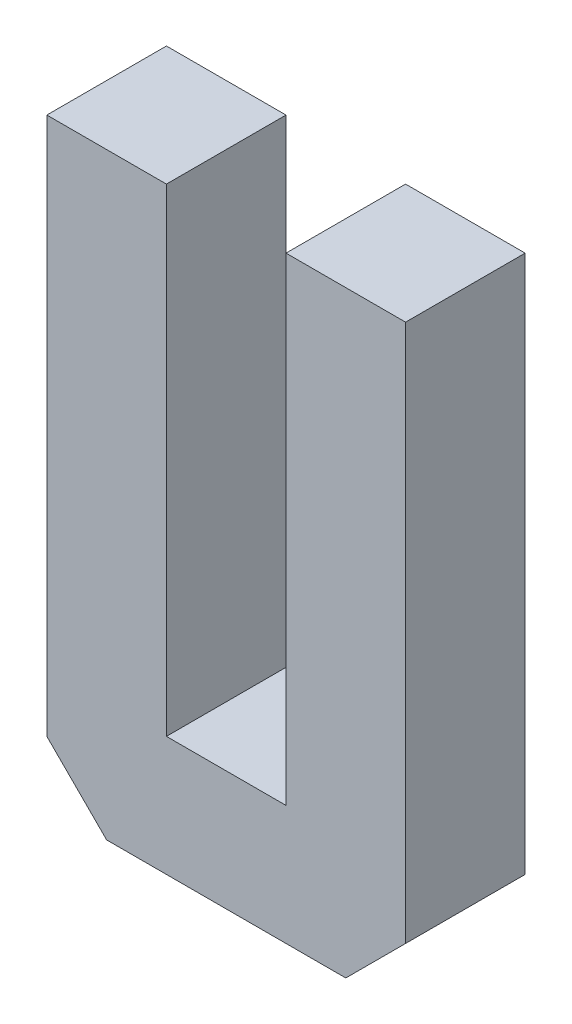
SolidWorks part; units mm, degrees
ref_plane "Plan de face" through (0, 0, 0) normal (0, 0, 1) x (1, 0, 0)
ref_plane "Plan de dessus" through (0, 0, 0) normal (0, 1, 0) x (1, 0, 0)
ref_plane "Plan de droite" through (0, 0, 0) normal (1, 0, 0) x (0, 0, -1)
sketch "Esquisse1" plane through (0, 0, 0) normal (0, 0, 1) x (1, 0, 0)
  line L0 (20, 50) -> (30, 50)
  line L1 (0, 0) -> (30, 0)
  line L2 (0, 0) -> (0, 50)
  line L3 (0, 50) -> (10, 50)
  line L4 (30, 0) -> (30, 50)
  line L6 (10, 50) -> (10, 10)
  line L7 (10, 10) -> (20, 10)
  line L8 (20, 50) -> (20, 10)
  dimension "D1" = 50
  dimension "D2" = 30
  dimension "D3" = 10
  dimension "D4" = 10
  dimension "D5" = 10
extrude "Boss.-Extru.1" add sketch "Esquisse1" along normal blind 10
chamfer "Chanfrein1" distance 5 angle 45 2 edges at (30, 0, 5) (0, 0, 5)
